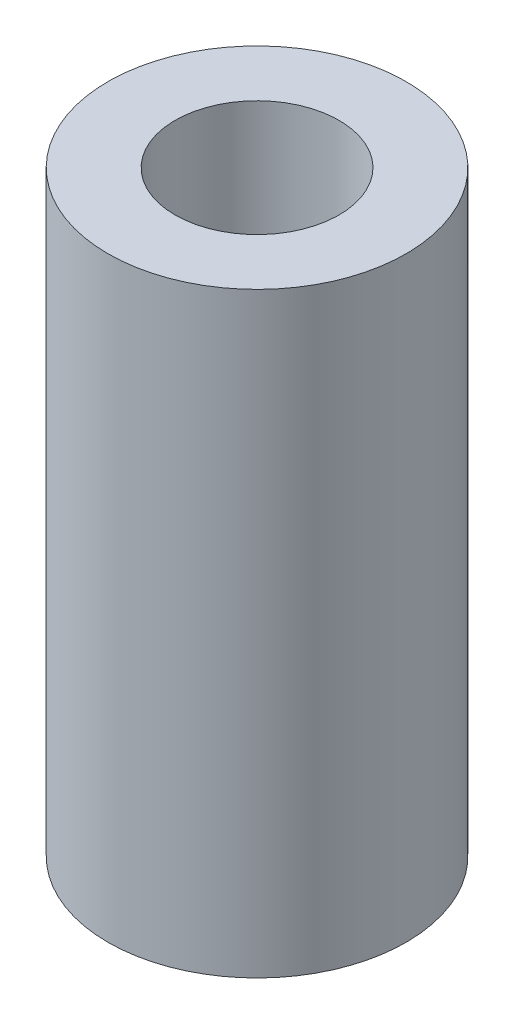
SolidWorks part; units mm, degrees
ref_plane "Front Plane" through (0, 0, 0) normal (0, 0, 1) x (1, 0, 0)
ref_plane "Top Plane" through (0, 0, 0) normal (0, 1, 0) x (1, 0, 0)
ref_plane "Right Plane" through (0, 0, 0) normal (1, 0, 0) x (0, 0, -1)
sketch "Sketch1" plane through (0, 0, 0) normal (0, 1, 0) x (1, 0, 0)
  circle A0 centre (0, 0) radius 2.75
  circle A1 centre (0, 0) radius 5
  dimension "D1" = 5.5
  dimension "D2" = 10
extrude "Boss-Extrude1" add sketch "Sketch1" along normal blind 20
